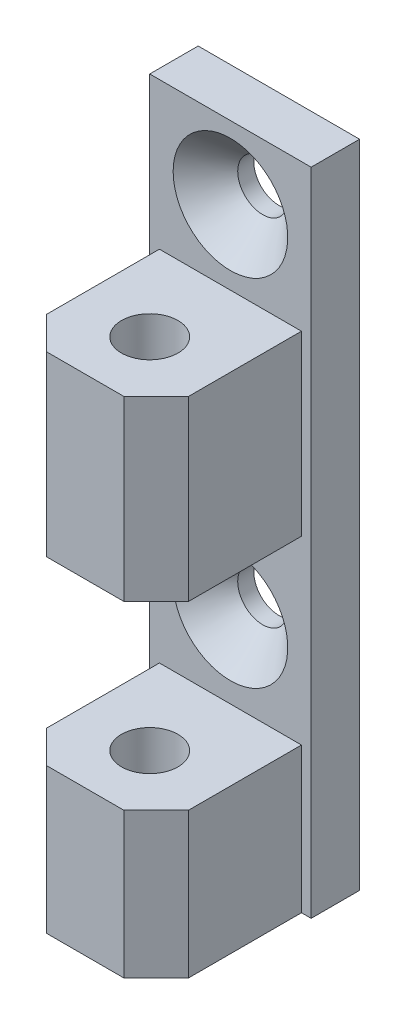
SolidWorks part; units mm, degrees
ref_plane "Face" through (0, 0, 0) normal (0, 0, 1) x (1, 0, 0)
ref_plane "Dessus" through (0, 0, 0) normal (0, 1, 0) x (1, 0, 0)
ref_plane "Droite" through (0, 0, 0) normal (1, 0, 0) x (0, 0, -1)
sketch "Esquisse1" plane through (0, 0, 0) normal (0, 1, 0) x (1, 0, 0)
  line L1 (0, 0) -> (10, 0)
  line L2 (0, 0) -> (0, 12)
  line L3 (0, 12) -> (10, 12)
  line L4 (10, 0) -> (10, 12)
extrude "Extrusion1" add sketch "Esquisse1" along normal blind 40.3
sketch "Esquisse2" plane through (0, 0, 0) normal (0, -1, 0) x (1, 0, 0)
  line L0 (-1.6894, -9) -> (11.2187, -9) construction
  line L1 (5, -12.3326) -> (5, 0.4541) construction
  line L2 (0, -12) -> (0, 0) construction
  line L3 (10, -12) -> (0, -12) construction
  line L4 (0.6, 0.4541) -> (0.6, -9.9939) construction
  line L5 (-0.6416, -2) -> (11.1124, -2) construction
  line L6 (0, 0) -> (10, 0) construction
  line L7 (2.6, 0.4541) -> (2.6, -4.8914) construction
  line L8 (0, -9) -> (0.6, -9)
  line L9 (0.6, -9) -> (0.6, -2)
  line L10 (0.6, -2) -> (2.6, 0)
  line L11 (2.6, 0) -> (0, 0)
  line L12 (0, 0) -> (0, -9)
  line L13 (10, -9) -> (9.4, -9)
  line L14 (9.4, -9) -> (9.4, -2)
  line L15 (9.4, -2) -> (7.4, 0)
  line L16 (7.4, 0) -> (10, 0)
  line L17 (10, 0) -> (10, -9)
  line L18 (4.3738, -4) -> (12.8474, -4) construction
  circle A0 centre (5, -4) radius 1.75
  dimension "D1" = 5
  dimension "D2" = 3
  dimension "D3" = 4.4
  dimension "D4" = 2
  dimension "D5" = 2
  dimension "D6" = 4
extrude "Enlèv. mat.-Extru.1" cut sketch "Esquisse2" against normal blind 40.6
sketch "Esquisse3" plane through (0, 0, 0) normal (0, 0, 1) x (1, 0, 0)
  line L0 (0, -2.6411) -> (0, 50.2588) construction
  line L1 (0, 40.3) -> (0, 0) construction
  line L2 (-0.8108, 0) -> (17.5281, 0) construction
  line L3 (-0.8108, 9) -> (18.008, 9) construction
  line L4 (-0.8108, 20.2) -> (18.008, 20.2) construction
  line L5 (-0.8108, 31.2) -> (18.008, 31.2) construction
  line L6 (-0.8108, 40.3) -> (18.008, 40.3) construction
  line L8 (0, 40.3) -> (10.2815, 40.3)
  line L9 (0, 40.3) -> (0, 31.2)
  line L10 (0, 31.2) -> (10.2815, 31.2)
  line L11 (10.2815, 40.3) -> (10.2815, 31.2)
  line L12 (0, 20.2) -> (10.2815, 20.2)
  line L13 (0, 20.2) -> (0, 9)
  line L14 (0, 9) -> (10.2815, 9)
  line L15 (10.2815, 20.2) -> (10.2815, 9)
  dimension "D1" = 9
  dimension "D2" = 11.2
  dimension "D3" = 11
  dimension "D4" = 9.1
extrude "Enlèv. mat.-Extru.2" cut sketch "Esquisse3" against normal blind 9
sketch "Esquisse4" plane through (0, 0, -9) normal (0, 0, 1) x (1, 0, 0)
  line L0 (5, 41.542) -> (5, 7.5788) construction
  line L1 (-2.0934, 13.8) -> (21.4746, 13.8) construction
  line L2 (-2.0934, 35.8) -> (21.4746, 35.8) construction
  line L3 (0, 40.3) -> (10, 40.3) construction
  line L5 (10, 40.3) -> (10, 0) construction
  circle A0 centre (5, 35.8) radius 1.55
  circle A1 centre (5, 13.8) radius 1.55
  dimension "D1" = 22
  dimension "D2" = 4.5
  dimension "D3" = 5
extrude "Enlèv. mat.-Extru.3" cut sketch "Esquisse4" against normal through all
chamfer "Chanfrein1" distance 2 angle 45 2 edges at (6.55, 13.8, -9) (6.55, 35.8, -9)
